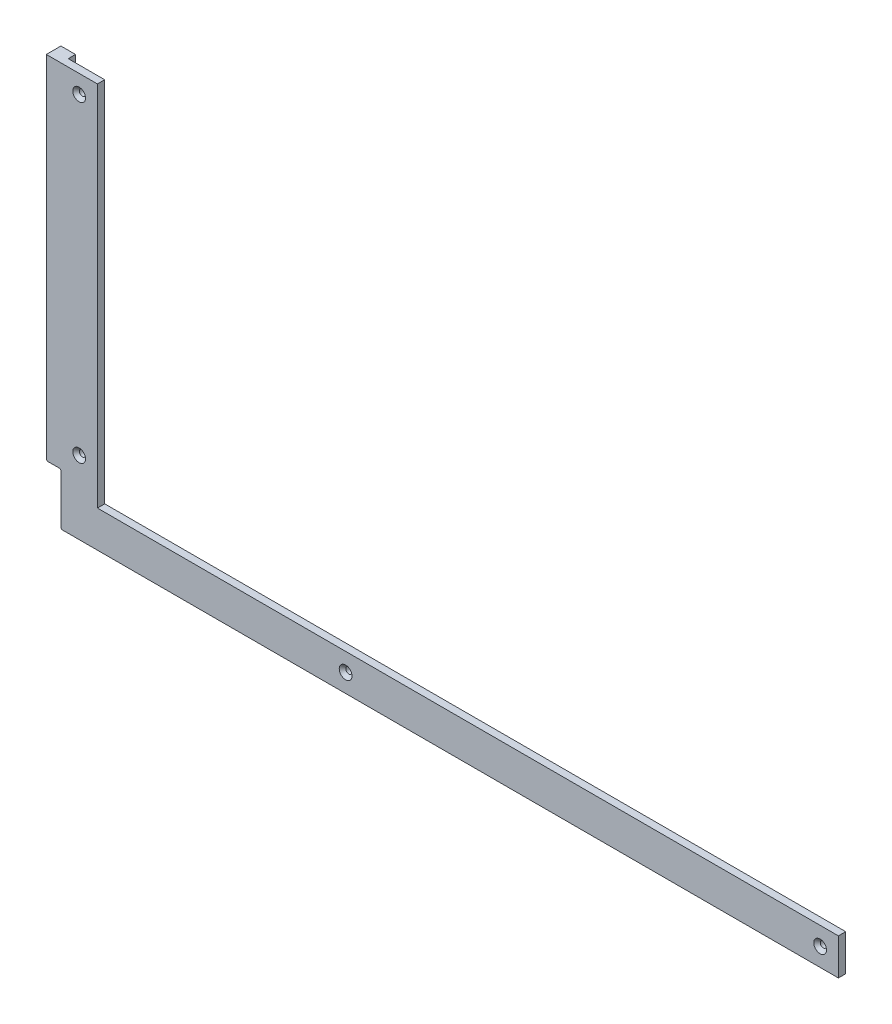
SolidWorks part; units mm, degrees
ref_plane "Ebene vorne" through (0, 0, 0) normal (0, 0, 1) x (1, 0, 0)
ref_plane "Ebene oben" through (0, 0, 0) normal (0, 1, 0) x (1, 0, 0)
ref_plane "Ebene rechts" through (0, 0, 0) normal (1, 0, 0) x (0, 0, -1)
sketch "Skizze1" plane through (0, 0, 0) normal (0, 0, 1) x (1, 0, 0)
  line L1 (-396, -191.25) -> (396, -191.25)
  line L2 (-396, -191.25) -> (-396, 191.25)
  line L3 (-396, 191.25) -> (396, 191.25)
  line L4 (396, -191.25) -> (396, 191.25)
  line L5 (-396, -191.25) -> (396, 191.25) construction
  line L6 (-396, 191.25) -> (396, -191.25) construction
  line L7 (-416, -211.25) -> (416, -211.25)
  line L8 (-416, -211.25) -> (-416, 211.25)
  line L9 (-416, 211.25) -> (416, 211.25)
  line L10 (416, -211.25) -> (416, 211.25)
  line L11 (-416, -211.25) -> (416, 211.25) construction
  line L12 (-416, 211.25) -> (416, -211.25) construction
  point P0 (0, 0)
  point P6 (0, 0)
  dimension "D1" = 832
  dimension "D2" = 422.5
  dimension "D3" = 20
  dimension "D4" = 20
extrude "Aufsatz-Linear austragen1" add sketch "Skizze1" along normal blind 8
fillet "Verrundung1" radius 1 4 edges at (-416, 211.25, 4) (-416, -211.25, 4) (416, -211.25, 4) (416, 211.25, 4)
sketch "Skizze2" plane through (0, 0, 0) normal (0, 0, -1) x (-1, 0, 0)
  line L0 (-416, -210.25) -> (-416, 210.25) construction
  line L1 (-408.5, 203.75) -> (408.5, 203.75)
  line L2 (-408.5, 203.75) -> (-408.5, -203.75)
  line L3 (-408.5, -203.75) -> (408.5, -203.75)
  line L4 (408.5, 203.75) -> (408.5, -203.75)
  line L5 (-415, 211.25) -> (415, 211.25) construction
  line L6 (416, 210.25) -> (416, -210.25) construction
  line L7 (415, -211.25) -> (-415, -211.25) construction
  dimension "D1" = 7.5
  dimension "D2" = 7.5
  dimension "D3" = 7.5
  dimension "D4" = 7.5
extrude "Schnitt-Linear austragen1" cut sketch "Skizze2" against normal blind 4
hole_wizard "Formsenkung für M3 Senkschraube mit Innensechskant1" positions "Skizze3" profile "Skizze4" countersink size "M3" standard "DIN"
sketch "Skizze3" plane through (0, 0, 8) normal (0, 0, 1) x (1, 0, 0)
  line L0 (-416, 210.25) -> (-416, -210.25) construction
  line L1 (416, -210.25) -> (416, 210.25) construction
  line L2 (-415, -211.25) -> (415, -211.25) construction
  line L3 (415, 211.25) -> (-415, 211.25) construction
  point P0 (-260, -201.25)
  point P2 (260, -201.25)
  point P4 (260, 201.25)
  point P6 (-260, 201.25)
  point P8 (406, 171.25)
  point P10 (406, -171.25)
  point P12 (-406, -171.25)
  point P14 (-406, 171.25)
  point P26 (-406, 0)
  point P32 (406, 0)
  point P37 (0, -201.25)
  point P39 (0, 201.25)
  dimension "D1" = 156
  dimension "D2" = 156
  dimension "D3" = 10
  dimension "D4" = 10
  dimension "D5" = 10
  dimension "D6" = 10
  dimension "D7" = 40
  dimension "D8" = 40
sketch "Skizze4" plane through (-260, -201.25, 8) normal (1, 0, 0) x (0, -1, 0)
  line L0 (0, 0) -> (0, 8)
  line L1 (0, 8) -> (1.7, 8)
  line L2 (1.7, 8) -> (1.7, 1.8)
  line L3 (1.7, 1.8) -> (3.5, 0)
  line L5 (3.5, 0) -> (0, 0)
  line L6 (-1.7, 1.8) -> (-3.5, 0) construction
  line L11 (0, -6.35) -> (0, 107.95) construction
  dimension "Bohrerdurchmesser" = 3.4
  dimension "Bohrungstiefe" = 8
  dimension "Senkdurchmesser (Oben)" = 7
  dimension "Senkwinkel (Oben)" = 90
sketch "Skizze5" plane through (0, 0, 0) normal (1, 0, 0) x (0, 0, -1)
  line L0 (-8, 211.25) -> (-8, 10)
  line L1 (-8, -210.25) -> (-8, 210.25) construction
  line L2 (-8, 10) -> (-4, 10)
  line L3 (-4, 10) -> (-4, -10)
  line L4 (-4, -10) -> (0, -10)
  line L5 (0, -210.25) -> (0, 210.25) construction
  line L6 (0, -10) -> (0, 211.25)
  line L7 (0, 211.25) -> (-8, 211.25)
  dimension "D1" = 10
  dimension "D2" = 10
  dimension "D3" = 4
extrude "Schnitt-Linear austragen2" cut sketch "Skizze5" against normal through all
sketch "Skizze6" plane through (0, 0, 0) normal (1, 0, 0) x (0, 0, -1)
  line L0 (-8, 211.25) -> (-8, -10)
  line L1 (-8, -210.25) -> (-8, 210.25) construction
  line L2 (-8, -10) -> (-4, -10)
  line L3 (-4, -10) -> (-4, 10)
  line L4 (-4, 10) -> (0, 10)
  line L5 (0, -210.25) -> (0, 210.25) construction
  line L6 (0, 10) -> (0, 211.25)
  line L7 (0, 211.25) -> (-8, 211.25)
  dimension "D1" = 10
  dimension "D2" = 4
  dimension "D3" = 10
extrude "Schnitt-Linear austragen3" cut sketch "Skizze6" along normal through all
sketch "Skizze7" plane through (0, 0, 0) normal (0, 1, 0) x (1, 0, 0)
  line L0 (416, -8) -> (10, -8)
  line L1 (-396, -8) -> (396, -8) construction
  line L2 (10, -8) -> (10, -4)
  line L3 (396, -4) -> (-396, -4) construction
  line L4 (10, -4) -> (-10, -4)
  line L5 (-10, -4) -> (-10, 0)
  line L6 (408.5, 0) -> (-408.5, 0) construction
  line L7 (-10, 0) -> (416, 0)
  line L8 (416, 0) -> (416, -8)
  dimension "D1" = 10
  dimension "D2" = 10
extrude "Schnitt-Linear austragen4" cut sketch "Skizze7" against normal through all both and the other way through all
sketch "Skizze8" plane through (0, 0, 8) normal (0, 0, 1) x (1, 0, 0)
  line L0 (-415, -211.25) -> (10, -211.25) construction
  line L1 (-416, 10) -> (-424, 10)
  line L2 (-416, 10) -> (-416, -182.75)
  line L3 (-416, -182.75) -> (-424, -182.75)
  line L4 (-424, 10) -> (-424, -182.75)
  dimension "D1" = 28.5
  dimension "D2" = 8
extrude "Aufsatz-Linear austragen2" add sketch "Skizze8" against normal up to surface (8 mm away)
fillet "Verrundung2" radius 1 2 edges at (-416, -182.75, 4) (-424, -182.75, 4)
